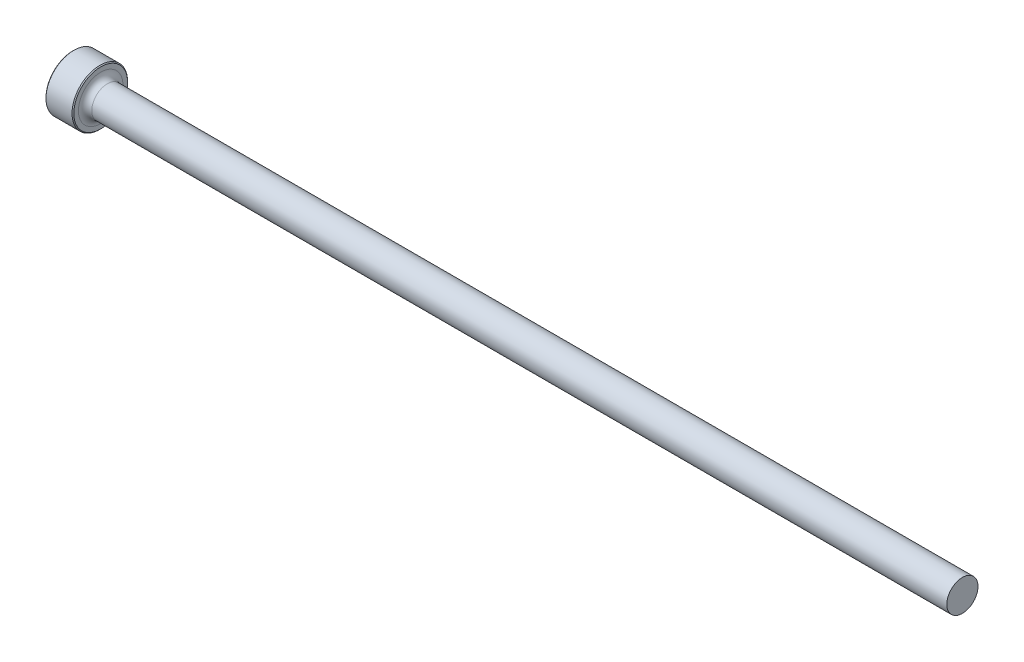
SolidWorks part; units mm, degrees
ref_plane "Front Plane" through (0, 0, 0) normal (0, 0, 1) x (1, 0, 0)
ref_plane "Top Plane" through (0, 0, 0) normal (0, 1, 0) x (1, 0, 0)
ref_plane "Right Plane" through (0, 0, 0) normal (1, 0, 0) x (0, 0, -1)
sketch "Sketch1" plane through (0, 0, 0) normal (0, 0, 1) x (1, 0, 0)
  line L0 (0, 0) -> (0, 3.175)
  line L1 (0, 3.175) -> (3.175, 3.175)
  line L2 (3.175, 3.175) -> (3.175, 2.5441)
  line L3 (3.937, 1.7821) -> (101.6, 1.7821)
  line L4 (101.6, 1.7821) -> (101.6, 0)
  line L5 (101.6, 0) -> (0, 0)
  line L6 (101.6, 0) -> (101.6, -1.7821) construction
  line L7 (101.6, -1.7821) -> (3.175, -1.7821) construction
  line L8 (0, 0) -> (0, -3.175) construction
  line L9 (0, -3.175) -> (3.175, -3.175) construction
  line L10 (3.175, -3.175) -> (3.175, -1.7821) construction
  arc A0 (3.175, 2.5441) -> (3.937, 1.7821) centre (3.937, 2.5441) ccw
  dimension "D4" = 0.762
  dimension "L" = 101.6
  dimension "D" = 3.5643
  dimension "H" = 6.35
  dimension "T" = 3.175
revolve "Revolve1" add sketch "Sketch1" angle 360 about L5
chamfer "Chamfer1" distance 0.1016 angle 45 2 edges at (0, 3.175, 0) (3.175, 3.175, 0)
